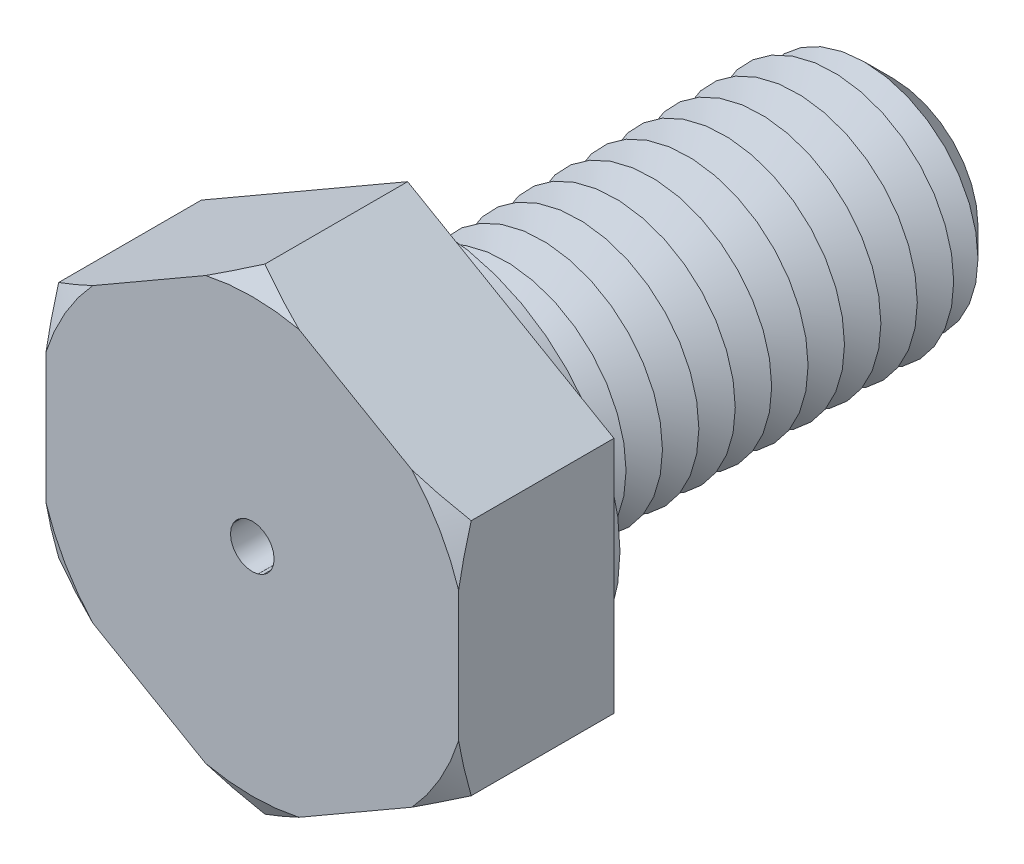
SolidWorks part; units mm, degrees
ref_plane "Front Plane" through (0, 0, 0) normal (0, 0, 1) x (1, 0, 0)
ref_plane "Top Plane" through (0, 0, 0) normal (0, 1, 0) x (1, 0, 0)
ref_plane "Right Plane" through (0, 0, 0) normal (1, 0, 0) x (0, 0, -1)
sketch "Sketch2" plane through (0, 0, 0) normal (0, 0, 1) x (1, 0, 0)
  line L1 (0, 9.815) -> (-8.5, 4.9075)
  line L2 (-8.5, 4.9075) -> (-8.5, -4.9075)
  line L3 (-8.5, -4.9075) -> (0, -9.815)
  line L4 (0, -9.815) -> (8.5, -4.9075)
  line L5 (8.5, -4.9075) -> (8.5, 4.9075)
  line L6 (8.5, 4.9075) -> (0, 9.815)
  circle A0 centre (0, 0) radius 8.5 construction
  dimension "D1" = 17
extrude "Boss-Extrude1" add sketch "Sketch2" along normal blind 6.4
sketch "Sketch3" plane through (0, 0, 0) normal (0, 0, -1) x (-1, 0, 0)
  circle A0 centre (0, 0) radius 5
  dimension "D1" = 10
extrude "Boss-Extrude2" add sketch "Sketch3" along normal blind 20
sketch "Sketch4" plane through (0, 0, 0) normal (0, 0, -1) x (-1, 0, 0)
  circle A0 centre (0, 0) radius 7.75
  dimension "D1" = 15.5
extrude "Boss-Extrude3" add sketch "Sketch4" along normal blind 1
sketch "Sketch5" plane through (0, 0, 0) normal (1, 0, 0) x (0, 0, -1)
  line L0 (-3.2117, 0) -> (6.3192, 0) construction
chamfer "Chamfer1" distance 1.5 angle 45 1 edges at (-5, 0, -20)
sketch "Sketch6" plane through (0, 0, 0) normal (1, 0, 0) x (0, 0, -1)
  line L0 (1, 5) -> (1.75, 3.701)
  line L1 (1.75, 3.701) -> (2.5, 5)
  line L2 (18.5, 5) -> (1, 5) construction
  line L3 (2.5, 5) -> (1, 5)
  dimension "D1" = 1.5
revolve "Cut-Revolve1" cut sketch "Sketch6" angle 360 about L0
pattern_linear "LPattern1" count 12 spacing 1.5 along (0, 0, -1) of "Cut-Revolve1"
sketch "Sketch7" plane through (0, 0, 0) normal (1, 0, 0) x (0, 0, -1)
  line L0 (-6.4, 9.815) -> (-6.4, 8.915)
  line L1 (-6.4, 4.9075) -> (-6.4, 9.815) construction
  line L2 (-6.4, 8.915) -> (-5.8804, 9.815)
  line L3 (-6.4, 9.815) -> (0, 9.815) construction
  line L4 (-5.8804, 9.815) -> (-6.4, 9.815)
  dimension "D1" = 0.9
  dimension "D2" = 30
revolve "Cut-Revolve2" cut sketch "Sketch7" angle 360 about L0
sketch "Sketch8" plane through (0, 0, 6.4) normal (0, 0, 1) x (1, 0, 0)
  circle A0 centre (0, 0) radius 0.9
  dimension "D1" = 1.8
extrude "Cut-Extrude1" cut sketch "Sketch8" against normal up to surface (26.4 mm away)
